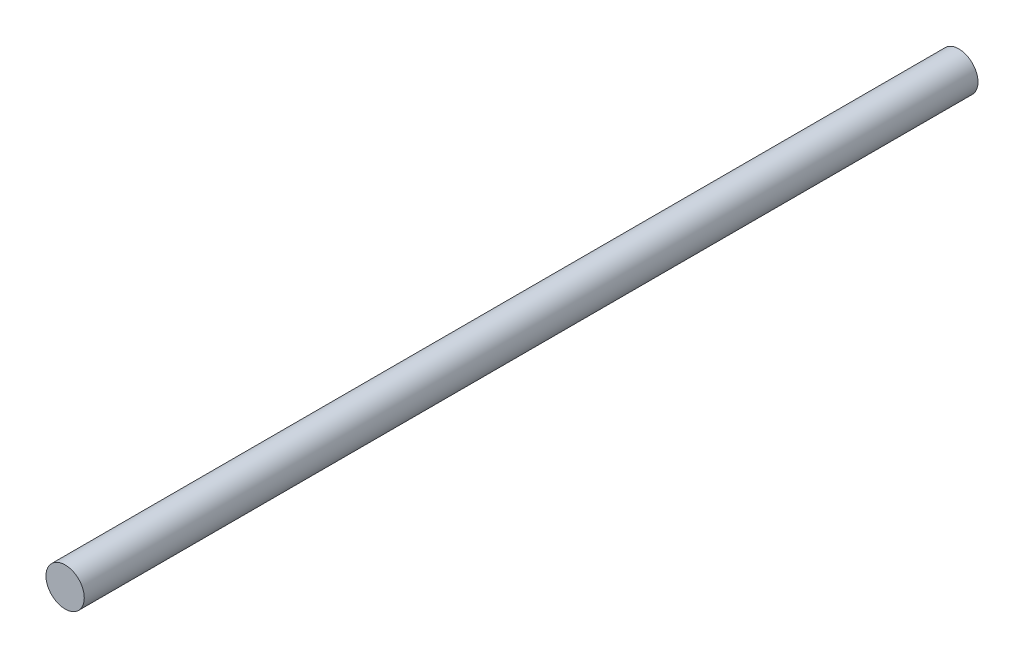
SolidWorks part; units mm, degrees
ref_plane "Front" through (0, 0, 0) normal (0, 0, 1) x (1, 0, 0)
ref_plane "Top" through (0, 0, 0) normal (0, 1, 0) x (1, 0, 0)
ref_plane "Right" through (0, 0, 0) normal (1, 0, 0) x (0, 0, -1)
sketch "Sketch1" plane through (0, 0, 0) normal (0, 0, 1) x (1, 0, 0)
  circle A0 centre (0, 0) radius 1.5
  dimension "D1" = 3
extrude "Boss-Extrude1" add sketch "Sketch1" along normal blind 70
